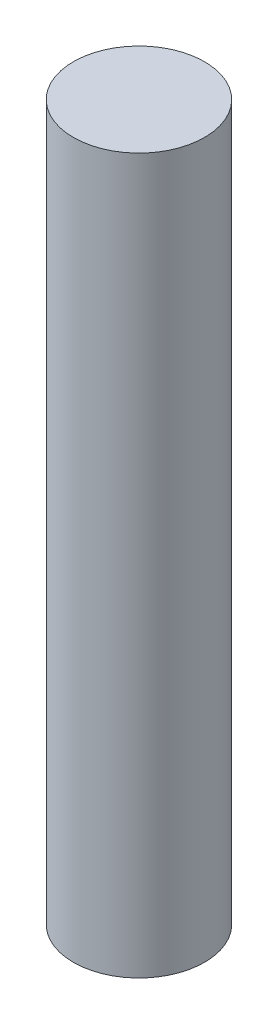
SolidWorks part; units mm, degrees
ref_plane "Front Plane" through (0, 0, 0) normal (0, 0, 1) x (1, 0, 0)
ref_plane "Top Plane" through (0, 0, 0) normal (0, 1, 0) x (1, 0, 0)
ref_plane "Right Plane" through (0, 0, 0) normal (1, 0, 0) x (0, 0, -1)
sketch "Sketch1" plane through (0, 0, 0) normal (0, 1, 0) x (1, 0, 0)
  circle A0 centre (0, 0) radius 2.25
  dimension "D1" = 4.5
extrude "Boss-Extrude1" add sketch "Sketch1" along normal blind 24.5
